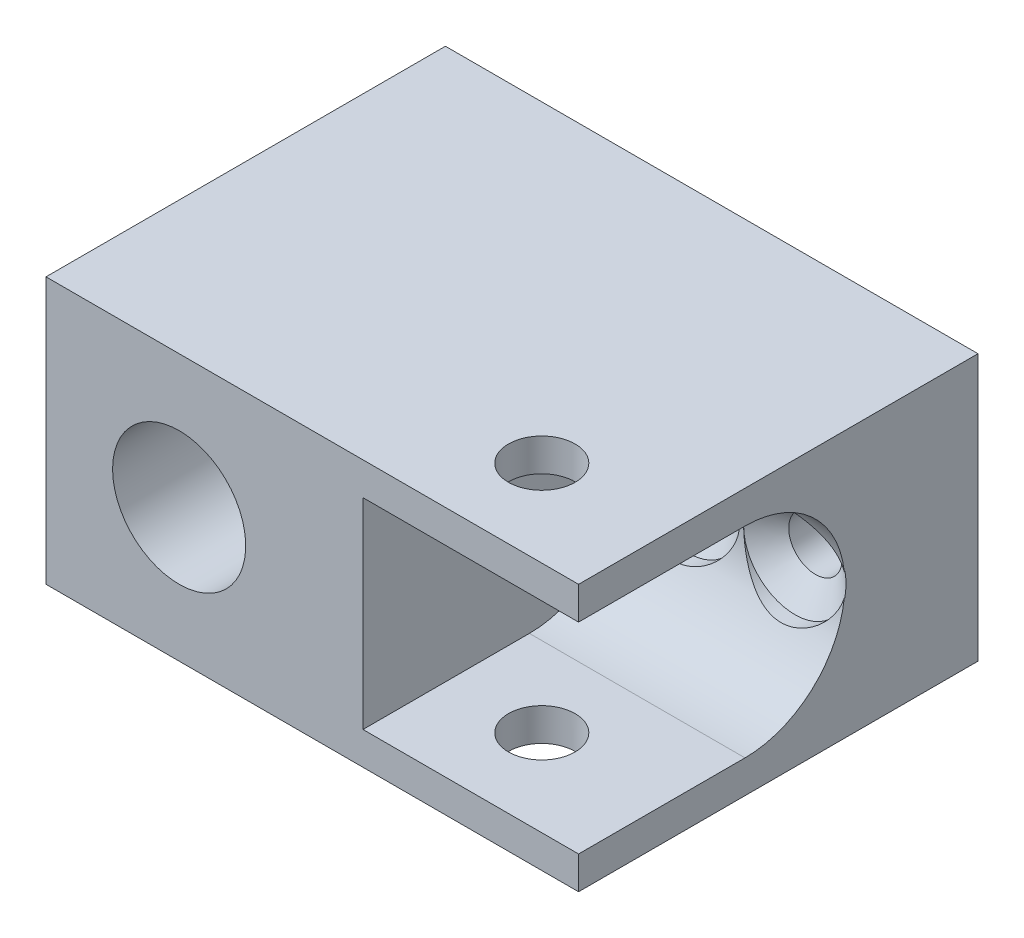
SolidWorks part; units mm, degrees
ref_plane "Front" through (0, 0, 0) normal (0, 0, 1) x (1, 0, 0)
ref_plane "Top" through (0, 0, 0) normal (0, 1, 0) x (1, 0, 0)
ref_plane "Right" through (0, 0, 0) normal (1, 0, 0) x (0, 0, -1)
sketch "Sketch1" plane through (0, 0, 0) normal (0, 0, 1) x (1, 0, 0)
  line L0 (25.4, 0) -> (0, 0) construction
  line L1 (50.8, -12.7) -> (0, -12.7)
  line L2 (50.8, -12.7) -> (50.8, 12.7)
  line L3 (50.8, 12.7) -> (0, 12.7)
  line L4 (0, -12.7) -> (0, 12.7)
  line L5 (50.8, -12.7) -> (0, 12.7) construction
  line L6 (50.8, 12.7) -> (0, -12.7) construction
  line L8 (0, 15.875) -> (0, -15.875) construction
  circle A0 centre (12.7, 0) radius 6.35 construction
  circle A1 centre (12.7, 0) radius 6.35
  point P3 (25.4, 0)
  dimension "D1" = 25.4
  dimension "D2" = 50.8
extrude "Boss-Extrude1" add sketch "Sketch1" along normal blind 38.1
sketch "Sketch2" plane through (0, 0, 38.1) normal (0, 0, 1) x (1, 0, 0)
  line L0 (50.8, -12.7) -> (50.8, 12.7) construction
  line L1 (71.3649, -9.5758) -> (30.2351, -9.5758)
  line L2 (71.3649, -9.5758) -> (71.3649, 9.5758)
  line L3 (71.3649, 9.5758) -> (30.2351, 9.5758)
  line L4 (30.2351, -9.5758) -> (30.2351, 9.5758)
  line L5 (71.3649, -9.5758) -> (30.2351, 9.5758) construction
  line L6 (71.3649, 9.5758) -> (30.2351, -9.5758) construction
  point P0 (50.8, 0)
extrude "Cut-Extrude1" cut sketch "Sketch2" against normal blind 25.4
sketch "Sketch3" plane through (0, 12.7, 0) normal (0, 1, 0) x (1, 0, 0)
  circle A0 centre (39.0362, -29.845) radius 3.175 construction
  circle A1 centre (39.0362, -29.845) radius 3.175
extrude "Cut-Extrude2" cut sketch "Sketch3" against normal through all
fillet "Fillet1" radius 9.525 2 edges at (40.5175, -9.5758, 12.7) (40.5175, 9.5758, 12.7)
sketch "Sketch4" plane through (0, 0, 12.7) normal (0, 0, 1) x (1, 0, 0)
  line L0 (50.8, -0.0508) -> (50.8, 0.0508) construction
  point P0 (46.0375, 0)
  point P1 (35.8775, 0)
  point P2 (50.8, 0)
  dimension "D1" = 4.7625
  dimension "D2" = 10.16
hole_wizard "CSK for #10 Flat Head Machine Screw (100)1" positions "Sketch6" profile "Sketch7" countersink size "#10" standard "ANSI Inch"
sketch "Sketch6" plane through (0, 0, 12.7) normal (0, 0, 1) x (1, 0, 0)
  point P0 (35.8775, 0)
  point P3 (46.0375, 0)
sketch "Sketch7" plane through (35.8775, 0, 12.7) normal (1, 0, 0) x (0, -1, 0)
  line L0 (0, 0) -> (0, 12.7)
  line L1 (0, 12.7) -> (2.5527, 12.7)
  line L2 (2.5527, 12.7) -> (2.5527, 1.9608)
  line L3 (2.5527, 1.9608) -> (4.8895, 0)
  line L5 (4.8895, 0) -> (0, 0)
  line L6 (-2.5527, 1.9608) -> (-4.8895, 0) construction
  line L11 (0, -6.35) -> (0, 107.95) construction
  dimension "Thru Hole Dia." = 5.1054
  dimension "Thru Hole Depth" = 12.7
  dimension "Near C'Sink Dia." = 9.779
  dimension "Near C'Sink Angle" = 100
sketch "Sketch9" plane through (0, 0, 12.7) normal (0, 0, -1) x (-1, 0, 0)
  line L2 (-50.8, 0.0508) -> (-41.1483, 0.0508)
  line L3 (-50.8, 1.1072) -> (-50.8, 0.0508)
  line L4 (-40.7667, 0.0508) -> (-30.9883, 0.0508)
  line L5 (-40.7667, 0.0508) -> (-30.9883, 0.0508) construction
  circle A1 centre (-46.0375, 0) radius 4.8895
  arc A2 (-30.9883, 0.0508) -> (-40.7667, 0.0508) centre (-35.8775, 0) ccw
  arc A3 (-41.1483, 0.0508) -> (-50.8, 1.1072) centre (-46.0375, 0) ccw
  arc A4 (-30.9883, 0.0508) -> (-40.7667, 0.0508) centre (-35.8775, 0) ccw
  arc A5 (-41.1483, 0.0508) -> (-50.8, 1.1072) centre (-46.0375, 0) ccw
  circle A6 centre (-35.8775, 0) radius 4.8895
  dimension "D1" = 0
  dimension "D2" = 0
extrude "Cut-Extrude4" cut sketch "Sketch9" against normal blind 10
